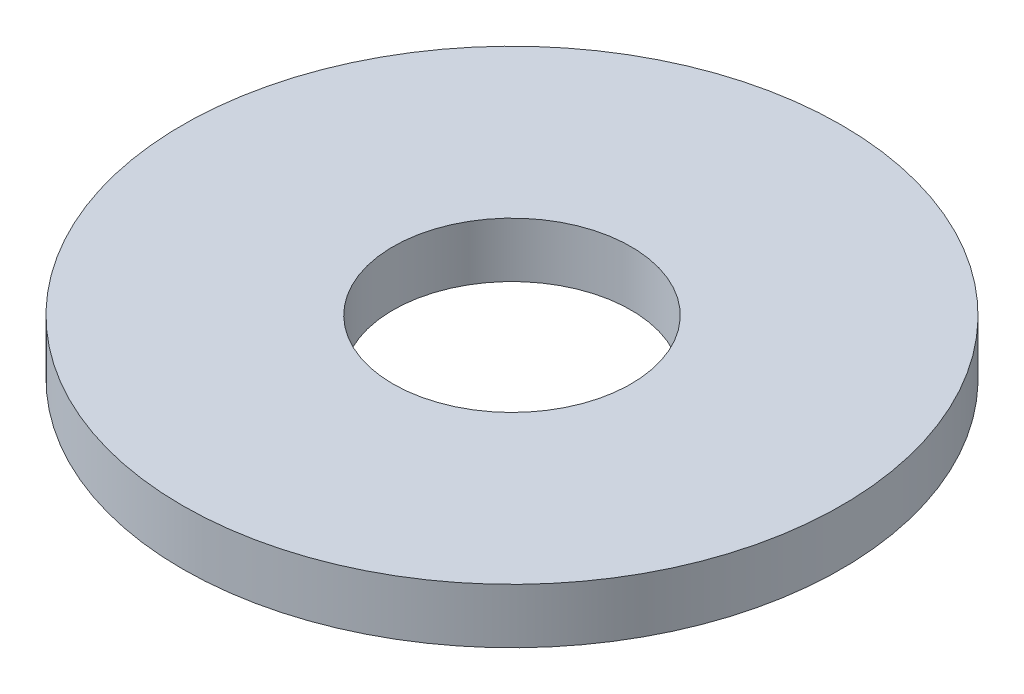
SolidWorks part; units mm, degrees
ref_plane "Front Plane" through (0, 0, 0) normal (0, 0, 1) x (1, 0, 0)
ref_plane "Top Plane" through (0, 0, 0) normal (0, 1, 0) x (1, 0, 0)
ref_plane "Right Plane" through (0, 0, 0) normal (1, 0, 0) x (0, 0, -1)
sketch "Sketch1" plane through (0, 0, 0) normal (0, 1, 0) x (1, 0, 0)
  circle A0 centre (0, 0) radius 6.5
  circle A1 centre (0, 0) radius 18
  dimension "D1" = 13
  dimension "D2" = 36
extrude "Boss-Extrude1" add sketch "Sketch1" along normal blind 3
